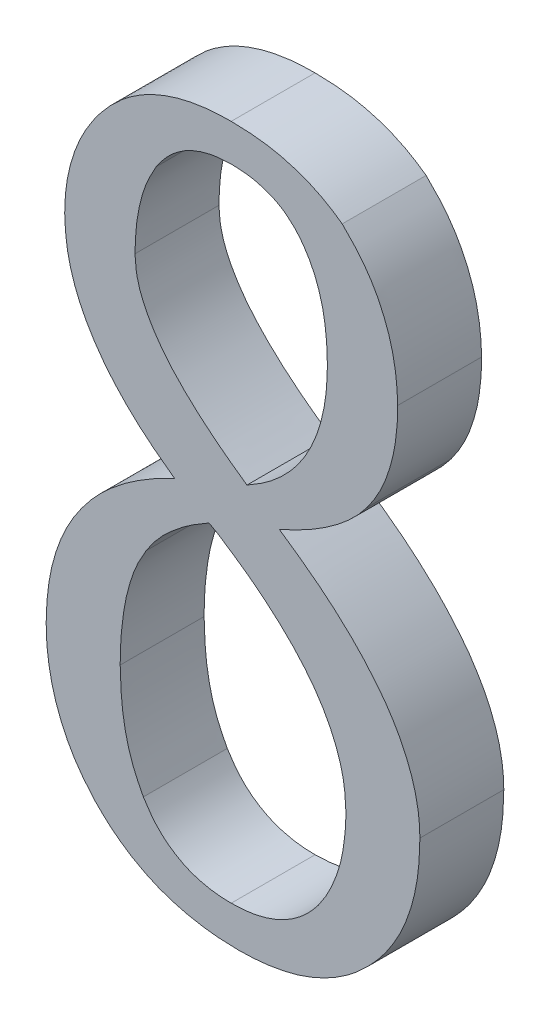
SolidWorks part; units mm, degrees
ref_plane "前基準面" through (0, 0, 0) normal (0, 0, 1) x (1, 0, 0)
ref_plane "上基準面" through (0, 0, 0) normal (0, 1, 0) x (1, 0, 0)
ref_plane "右基準面" through (0, 0, 0) normal (1, 0, 0) x (0, 0, -1)
sketch "草圖1" plane through (0, 0, 0) normal (0, 0, 1) x (1, 0, 0)
  text T0 "8" font "標楷體" height 25
extrude "填料-伸長1" add sketch "草圖1" along normal blind 3
